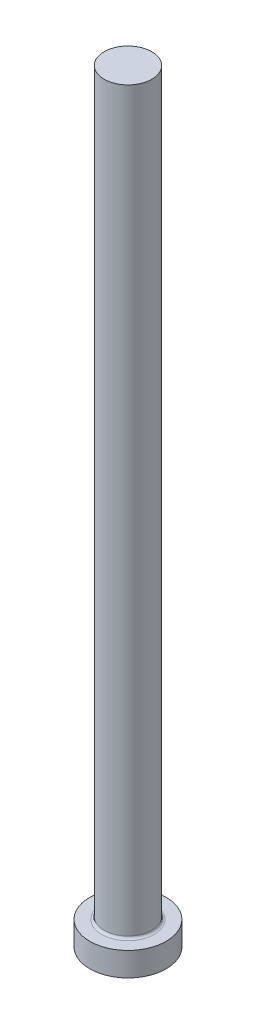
SolidWorks part; units mm, degrees
ref_plane "Plano frontal" through (0, 0, 0) normal (0, 0, 1) x (1, 0, 0)
ref_plane "Plano superior" through (0, 0, 0) normal (0, 1, 0) x (1, 0, 0)
ref_plane "Plano direito" through (0, 0, 0) normal (1, 0, 0) x (0, 0, -1)
sketch "Esboço1" plane through (0, 0, 0) normal (0, 0, 1) x (1, 0, 0)
  line L0 (0, 0) -> (8, 0)
  line L1 (8, 0) -> (8, 5)
  line L2 (8, 5) -> (5.5, 5)
  line L3 (5, 5.5) -> (5, 160)
  line L4 (5, 160) -> (0, 160)
  line L5 (0, 160) -> (0, 0) construction
  line L6 (0, 0) -> (0, 160)
  arc A0 (5.5, 5) -> (5, 5.5) centre (5.5, 5.5) cw
  dimension "D3" = 0.5
  dimension "D1" = 16
  dimension "D2" = 10
  dimension "D4" = 5
  dimension "D5" = 160
revolve "Revolução1" add sketch "Esboço1" angle 360 about L5
sketch "Esboço2"
  dimension "D1" = 0.9
  dimension "D2" = 1.4
  dimension "D3" = 4.3
  dimension "D4" = 0.6
wrap "Envolver1" sketch "Esboço2" wrap type deboss source sketch "Esboço2" thickness 0.1 parameters "D1"=0.1
